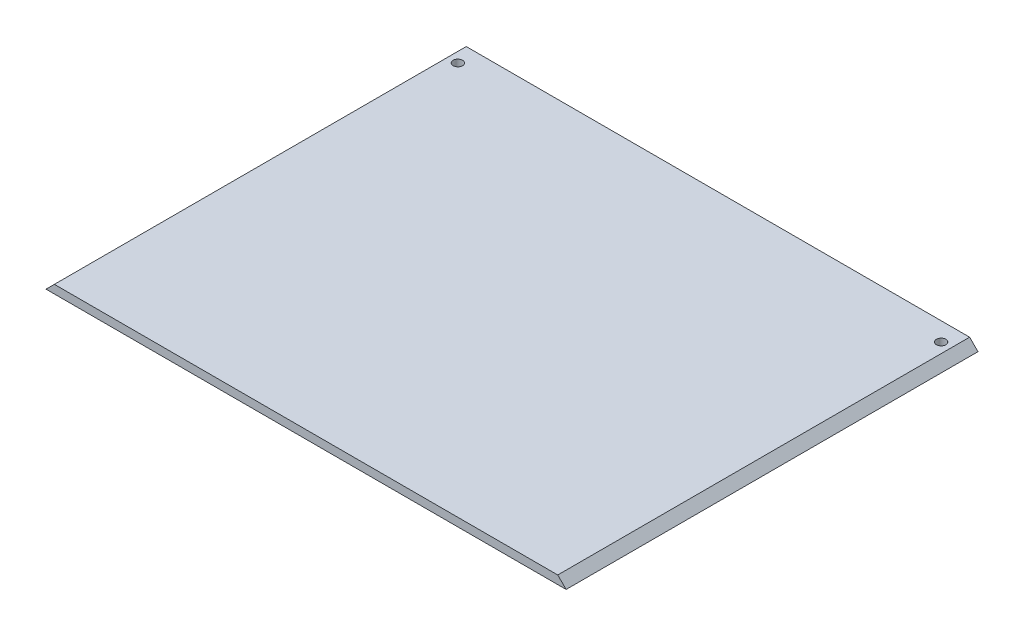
SolidWorks part; units mm, degrees
ref_plane "Front Plane" through (0, 0, 0) normal (0, 0, 1) x (1, 0, 0)
ref_plane "Top Plane" through (0, 0, 0) normal (0, 1, 0) x (1, 0, 0)
ref_plane "Right Plane" through (0, 0, 0) normal (1, 0, 0) x (0, 0, -1)
sketch "Sketch3" plane through (0, 0, 0) normal (0, 1, 0) x (1, 0, 0)
  line L1 (0, 0) -> (186.4, 0)
  line L2 (0, 0) -> (0, 147.6)
  line L3 (0, 147.6) -> (186.4, 147.6)
  line L4 (186.4, 0) -> (186.4, 147.6)
  dimension "D1" = 186.4
  dimension "D2" = 147.6
extrude "Boss-Extrude1" add sketch "Sketch3" against normal blind 3
sketch "Sketch5" plane through (0, 0, 0) normal (0, 0, 1) x (1, 0, 0)
  line L0 (0, -3) -> (0, 0)
  line L1 (0, 0) -> (3, 0)
  line L2 (0, 0) -> (186.4, 0) construction
  line L3 (3, 0) -> (0, -3)
  line L4 (186.4, -3) -> (183.4, 0)
  line L5 (183.4, 0) -> (186.4, 0)
  line L6 (186.4, 0) -> (186.4, -3)
  dimension "D1" = 3
  dimension "D2" = 3
extrude "Cut-Extrude2" cut sketch "Sketch5" against normal through all and the other way through all contours L4 M6 M3 | L3 M3 M4
hole_wizard "M3 Clearance Hole2" positions "Sketch9" profile "Sketch10" hole size "M3" standard "ANSI Metric"
sketch "Sketch9" plane through (0, 0, 0) normal (0, 1, 0) x (1, 0, 0)
  line L0 (0, 147.6) -> (186.4, 147.6) construction
  line L1 (3, 147.6) -> (3, 0) construction
  line L2 (183.4, 147.6) -> (183.4, 0) construction
  point P0 (6.6, 141)
  point P7 (179.8, 141)
  dimension "D1" = 6.6
  dimension "D2" = 3.6
  dimension "D3" = 6.6
  dimension "D4" = 3.6
sketch "Sketch10" plane through (6.6, 0, -141) normal (1, 0, 0) x (0, 0, 1)
  line L0 (0, 0) -> (0, 3)
  line L1 (0, 3) -> (1.7, 3)
  line L2 (1.7, 3) -> (1.7, 0)
  line L5 (1.7, 0) -> (0, 0)
  line L11 (0, -6.35) -> (0, 107.95) construction
  dimension "Thru Hole Dia." = 3.4
  dimension "Thru Hole Depth" = 3
